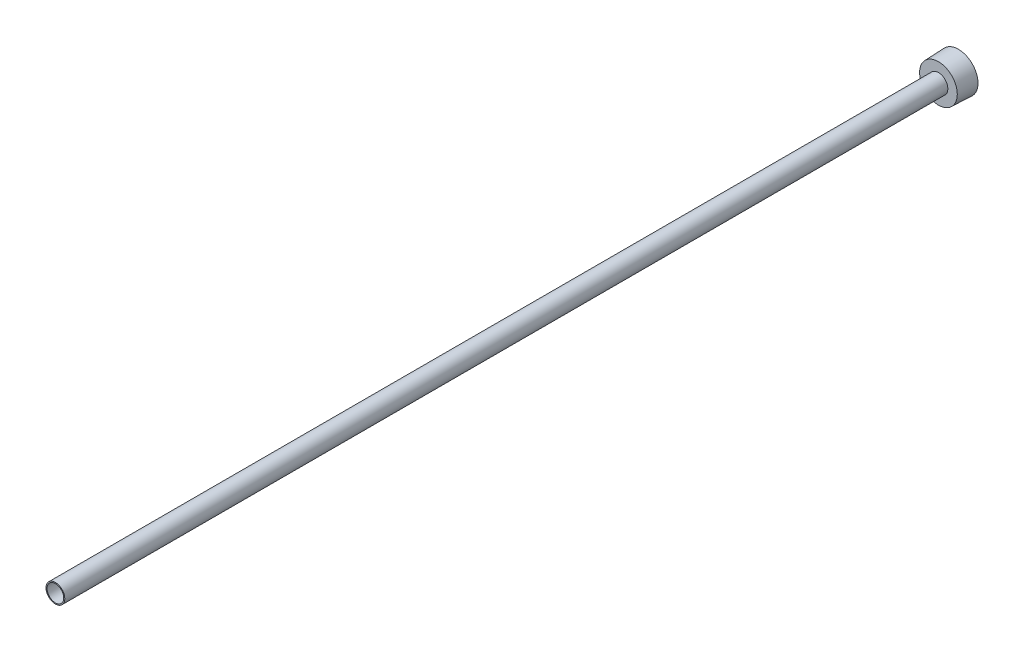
SolidWorks part; units mm, degrees
ref_plane "Front Plane" through (0, 0, 0) normal (0, 0, 1) x (1, 0, 0)
ref_plane "Top Plane" through (0, 0, 0) normal (0, 1, 0) x (1, 0, 0)
ref_plane "Right Plane" through (0, 0, 0) normal (1, 0, 0) x (0, 0, -1)
sketch "Sketch1" plane through (0, 0, 0) normal (1, 0, 0) x (0, 0, -1)
  line L0 (-278.0011, 0) -> (49721.9989, 0) construction
  line L1 (-609.6, 0) -> (0, 0)
  line L6 (0, 0) -> (0, 13.2207)
  line L7 (0, 13.2207) -> (-13.4874, 12.7287)
  line L8 (-13.4874, 12.7287) -> (-13.4874, 6.35)
  line L9 (-13.4874, 6.35) -> (-609.6, 6.35)
  line L10 (-609.6, 6.35) -> (-609.6, 0)
  dimension "D1" = 13.4874
  dimension "D2" = 26.4414
  dimension "D3" = 2.089
  dimension "D4" = 12.7
  dimension "D5" = 609.6
revolve "Revolve1" add sketch "Sketch1" angle 360 about L0
sketch "Sketch2" plane through (0, 0, 609.6) normal (0, 0, 1) x (1, 0, 0)
  circle A0 centre (0, 0) radius 5.6388
  dimension "D1" = 11.2776
extrude "Cut-Extrude1" cut sketch "Sketch2" against normal through all
sketch "Sketch3" plane through (0, 0, 0) normal (0, 0, -1) x (-1, 0, 0)
  line L0 (0, 14.5428) -> (0, -14.5428) construction
  line L1 (0, -10.9985) -> (9.525, -5.4993)
  line L2 (9.525, -5.4993) -> (9.525, 5.4993)
  line L3 (9.525, 5.4993) -> (0, 10.9985)
  line L4 (0, 10.9985) -> (-9.525, 5.4993)
  line L5 (-9.525, 5.4993) -> (-9.525, -5.4993)
  line L6 (-9.525, -5.4993) -> (0, -10.9985)
  circle A0 centre (0, 0) radius 9.525 construction
  dimension "D1" = 19.05
extrude "Cut-Extrude2" cut sketch "Sketch3" against normal blind 9.525
